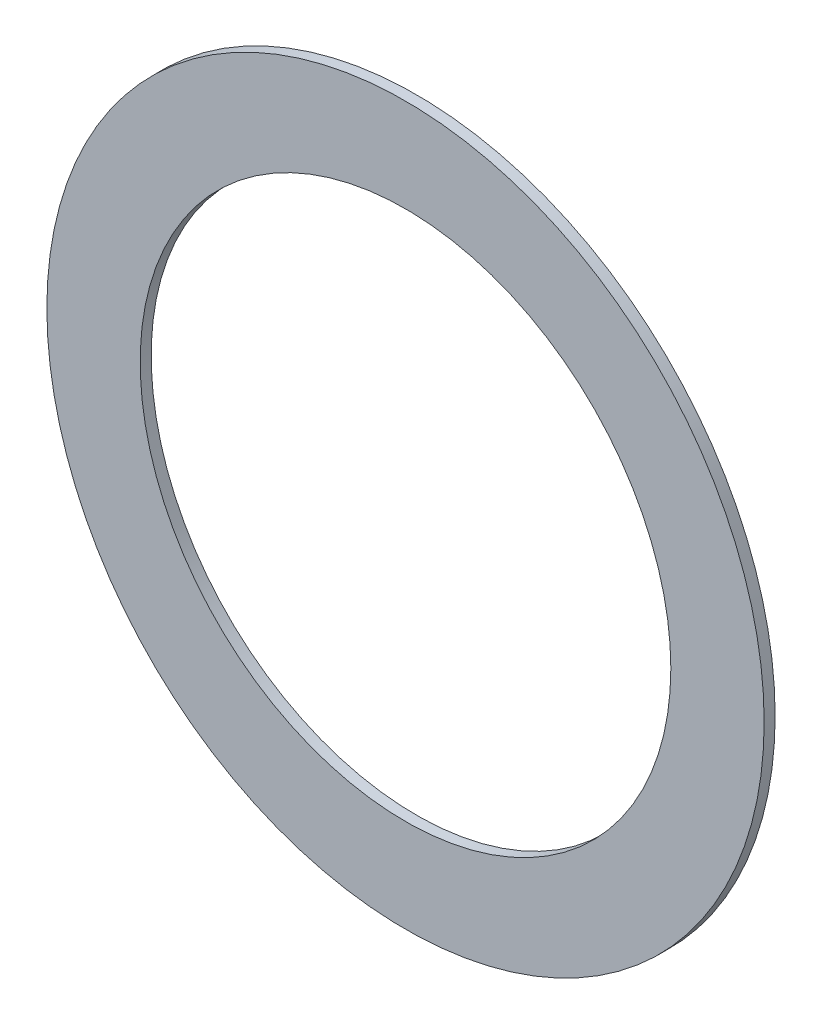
SolidWorks part; units mm, degrees
ref_plane "正面" through (0, 0, 0) normal (0, 0, 1) x (1, 0, 0)
ref_plane "平面" through (0, 0, 0) normal (0, 1, 0) x (1, 0, 0)
ref_plane "右側面" through (0, 0, 0) normal (1, 0, 0) x (0, 0, -1)
sketch "ｽｹｯﾁ1" plane through (0, 0, 0) normal (0, 0, 1) x (1, 0, 0)
  circle A0 centre (0, 0) radius 7.25
  circle A1 centre (0, 0) radius 9.8
  point P5 (0, -0.1052)
  dimension "D1" = 14.5
  dimension "D2" = 19.6
extrude "ﾎﾞｽ - 押し出し1" add sketch "ｽｹｯﾁ1" along normal blind 0.3
